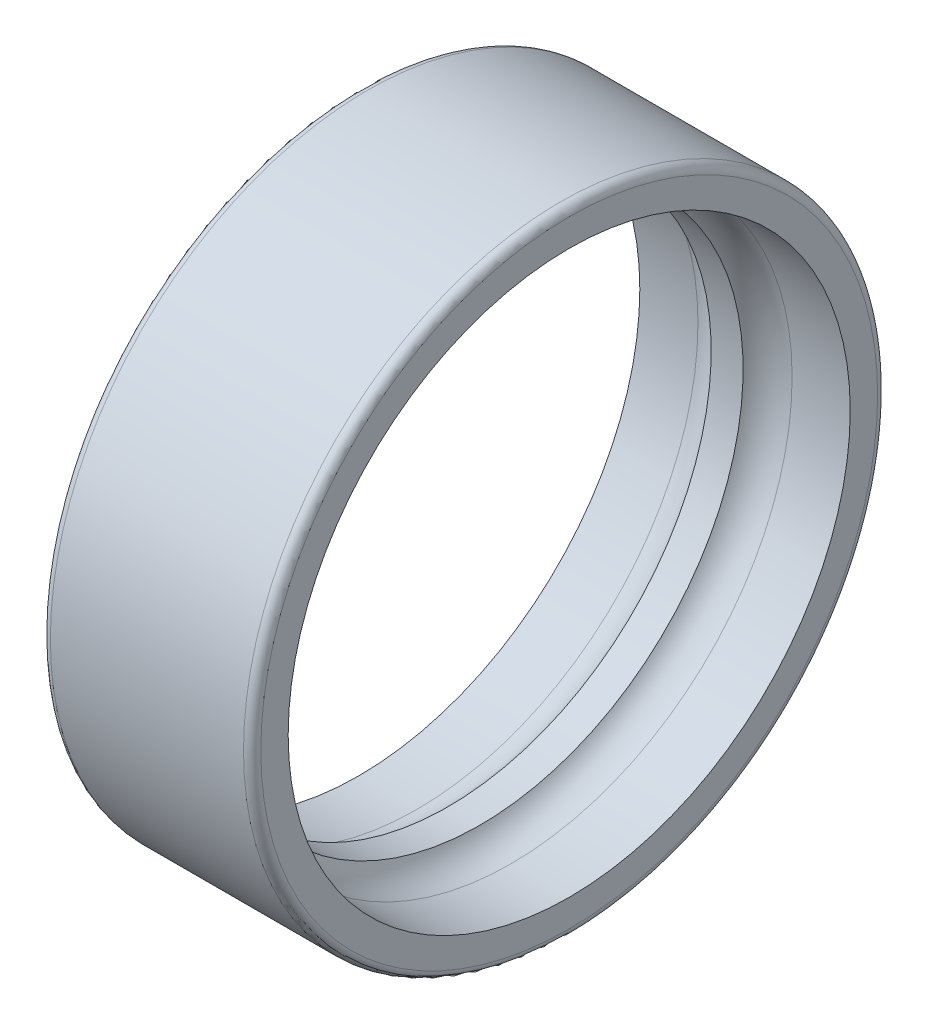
SolidWorks part; units mm, degrees
ref_plane "Plan de face" through (0, 0, 0) normal (0, 0, 1) x (1, 0, 0)
ref_plane "Plan de dessus" through (0, 0, 0) normal (0, 1, 0) x (1, 0, 0)
ref_plane "Plan de droite" through (0, 0, 0) normal (1, 0, 0) x (0, 0, -1)
sketch "Esquisse1" plane through (0, 0, 0) normal (0, 0, 1) x (1, 0, 0)
  line L0 (0, 55) -> (0, 30) construction
  line L1 (-16.75, 55) -> (16.75, 55)
  line L2 (-18.25, 53.5) -> (-18.25, 31.5) construction
  line L3 (-16.75, 30) -> (16.75, 30) construction
  line L4 (18.25, 53.5) -> (18.25, 31.5) construction
  line L5 (18.25, 45.65) -> (2.7685, 45.65) construction
  line L6 (18.25, 39.4) -> (-18.25, 39.4) construction
  line L7 (-18.25, 42.5) -> (18.25, 42.5) construction
  line L8 (-8.1667, 30) -> (-8.1667, 55) construction
  line L9 (0, 0) -> (18.25, 0) construction
  line L10 (18.25, 53.5) -> (18.25, 48.75)
  line L11 (-18.25, 53.5) -> (-18.25, 48.75)
  line L12 (2.7685, 45.65) -> (-2.7685, 45.65)
  line L13 (-2.7685, 45.65) -> (-18.25, 45.65) construction
  line L14 (-8.1667, 48.75) -> (-18.25, 48.75)
  line L15 (8.1667, 48.75) -> (18.25, 48.75)
  arc A1 (-18.25, 31.5) -> (-16.75, 30) centre (-16.75, 31.5) ccw construction
  arc A2 (-16.75, 55) -> (-18.25, 53.5) centre (-16.75, 53.5) ccw
  arc A3 (18.25, 53.5) -> (16.75, 55) centre (16.75, 53.5) ccw
  arc A4 (16.75, 30) -> (18.25, 31.5) centre (16.75, 31.5) ccw construction
  arc A6 (-2.7685, 45.65) -> (-8.1667, 48.75) centre (-8.1667, 42.5) ccw
  arc A7 (2.7685, 45.65) -> (8.1667, 48.75) centre (8.1667, 42.5) cw
  arc A8 (-14.4167, 42.5) -> (-1.9167, 42.5) centre (-8.1667, 42.5) ccw construction
  dimension "D4" = 1.5
  dimension "D5" = 10.0833
  dimension "D8" = 12.5
  dimension "D1" = 30
  dimension "D2" = 55
  dimension "D3" = 36.5
  dimension "D6" = 39.4
  dimension "D7" = 45.65
revolve "Révolution1" add sketch "Esquisse1" angle 360 about L9
equation "\"D5@Esquisse1\"=(\"D3@Esquisse1\"-2*\"D8@Esquisse1\")/3+\"D8@Esquisse1\"/2"
